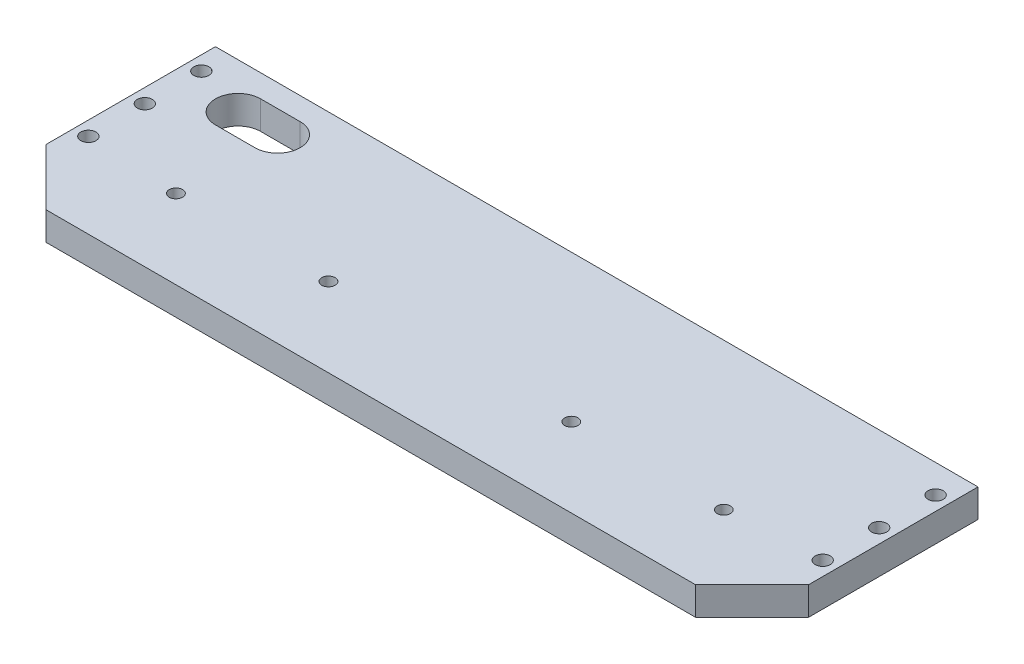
SolidWorks part; units mm, degrees
ref_plane "Front Plane" through (0, 0, 0) normal (0, 0, 1) x (1, 0, 0)
ref_plane "Top Plane" through (0, 0, 0) normal (0, 1, 0) x (1, 0, 0)
ref_plane "Right Plane" through (0, 0, 0) normal (1, 0, 0) x (0, 0, -1)
sketch "Sketch1" plane through (0, 0, 0) normal (0, 0, 1) x (1, 0, 0)
  line L0 (-223.8, 279.4) -> (-12.7, 279.4) construction
  line L1 (-32.5251, 279.4) -> (-203.9751, 279.4)
  line L2 (-32.5251, 279.4) -> (-32.5251, 273.05)
  line L3 (-32.5251, 273.05) -> (-203.9751, 273.05)
  line L4 (-203.9751, 279.4) -> (-203.9751, 273.05)
  line L5 (-12.474, 431.1636) -> (-12.474, 127.8876) construction
  dimension "D1" = 6.35
  dimension "D2" = 171.45
  dimension "D3" = 20.0511
extrude "Boss-Extrude1" add sketch "Sketch1" along normal blind 50.8
chamfer "Chamfer1" distance 12.7 angle 45 2 edges at (-203.9751, 276.225, 50.8) (-32.5251, 276.225, 50.8)
sketch "Sketch3" plane through (0, 279.4, 0) normal (0, 1, 0) x (1, 0, 0)
  circle A0 centre (-90.9451, -33.02) radius 1.5
  circle A1 centre (-56.6551, -33.02) radius 1.5
  circle A2 centre (-145.5551, -33.02) radius 1.5
  circle A3 centre (-179.8451, -33.02) radius 1.5
  dimension "D1" = 3
  dimension "D2" = 3
extrude "Cut-Extrude2" cut sketch "Sketch3" against normal through all
sketch "Sketch4" plane through (0, 279.4, 0) normal (0, 1, 0) x (1, 0, 0)
  line L0 (-203.9751, -38.1) -> (-203.9751, 0) construction
  line L1 (-32.5251, 0) -> (-203.9751, 0) construction
  line L2 (-197.6251, 0) -> (-197.6251, -44.45) construction
  line L3 (-203.9751, -38.1) -> (-191.2751, -50.8) construction
  line L4 (-203.9751, -19.05) -> (-197.6251, -19.05) construction
  line L5 (-200.8001, -19.05) -> (-200.8001, 0) construction
  line L6 (-118.2501, 0) -> (-118.2501, -50.8) construction
  line L7 (-45.2251, -50.8) -> (-191.2751, -50.8) construction
  circle A0 centre (-200.8001, -6.35) radius 1.7
  circle A1 centre (-200.8001, -19.05) radius 1.7
  circle A2 centre (-200.8001, -31.75) radius 1.7
  circle A3 centre (-35.7001, -31.75) radius 1.7
  circle A4 centre (-35.7001, -19.05) radius 1.7
  circle A5 centre (-35.7001, -6.35) radius 1.7
  dimension "D2" = 3.4
  dimension "D1" = 6.35
  dimension "D3" = 12.7
extrude "Cut-Extrude3" cut sketch "Sketch4" against normal through all
sketch "Sketch5" plane through (0, 273.05, 0) normal (0, -1, 0) x (-1, 0, 0)
  line L0 (179.8451, -10.16) -> (188.7351, -10.16) construction
  line L1 (179.8451, -5.08) -> (188.7351, -5.08)
  line L2 (179.8451, -15.24) -> (188.7351, -15.24)
  line L3 (203.9751, 0) -> (32.5251, 0) construction
  line L4 (203.9751, -38.1) -> (203.9751, 0) construction
  arc A0 (179.8451, -5.08) -> (179.8451, -15.24) centre (179.8451, -10.16) ccw
  arc A1 (188.7351, -15.24) -> (188.7351, -5.08) centre (188.7351, -10.16) ccw
  point P2 (184.2901, -10.16)
  dimension "D1" = 10.16
  dimension "D2" = 15.24
  dimension "D3" = 10.16
  dimension "D4" = 8.89
extrude "Cut-Extrude4" cut sketch "Sketch5" against normal through all
